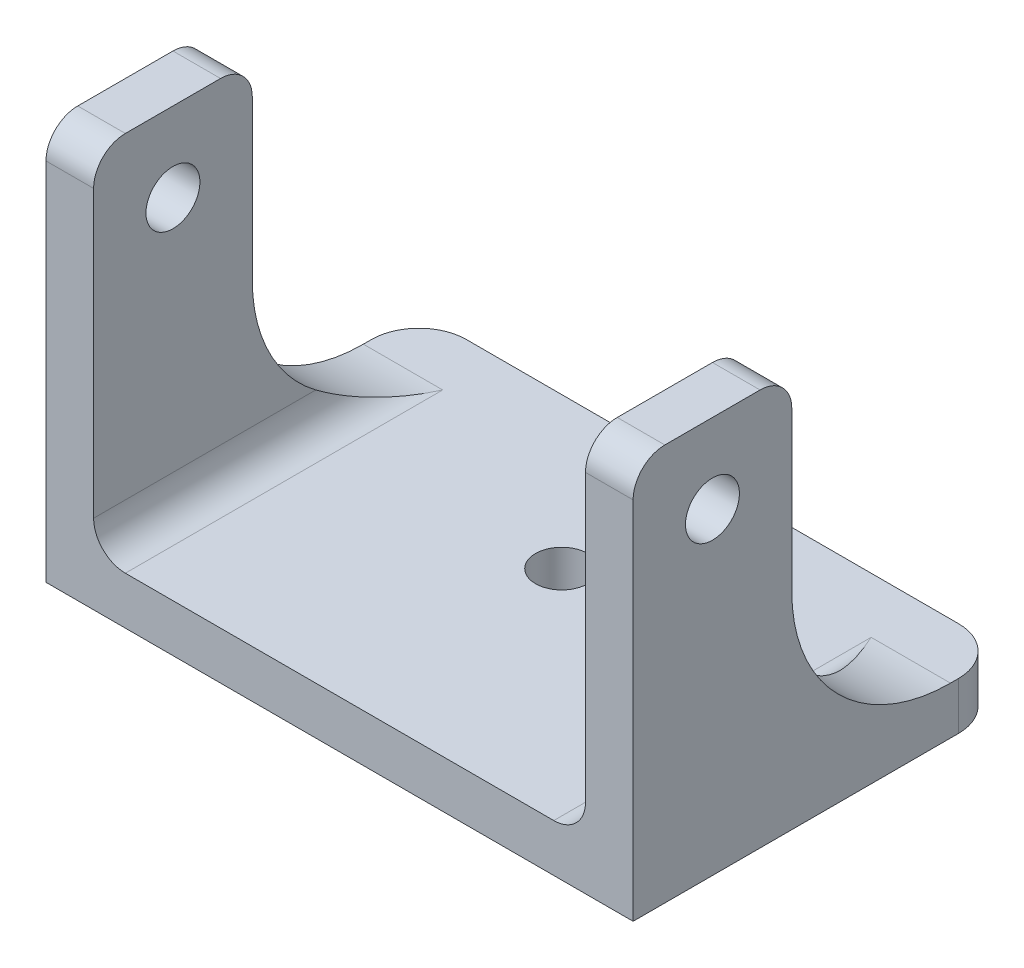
SolidWorks part; units mm, degrees
ref_plane "Plan de face" through (0, 0, 0) normal (0, 0, 1) x (1, 0, 0)
ref_plane "Plan de dessus" through (0, 0, 0) normal (0, 1, 0) x (1, 0, 0)
ref_plane "Plan de droite" through (0, 0, 0) normal (1, 0, 0) x (0, 0, -1)
sketch "Esquisse1" plane through (0, 0, 0) normal (0, 1, 0) x (1, 0, 0)
  line L0 (0, 0) -> (0, 10.9952) construction
  line L1 (-18.5, 9.5) -> (18.5, 9.5)
  line L2 (-18.5, 9.5) -> (-18.5, -14)
  line L3 (-18.5, -14) -> (18.5, -14)
  line L4 (18.5, 9.5) -> (18.5, -14)
  line L5 (0, 0) -> (11.155, 0) construction
  dimension "D1" = 14
  dimension "D2" = 23.5
  dimension "D3" = 37
extrude "Boss.-Extru.1" add sketch "Esquisse1" along normal blind 3
sketch "Esquisse2" plane through (0, 0, 0) normal (0, -1, 0) x (1, 0, 0)
  circle A0 centre (0, 0) radius 7
  dimension "D1" = 14
extrude "Boss.-Extru.2" add sketch "Esquisse2" along normal blind 3
sketch "Esquisse3" plane through (0, -3, 0) normal (0, -1, 0) x (1, 0, 0)
  circle A0 centre (0, 0) radius 1.65
  dimension "D1" = 3.3
extrude "Enlèv. mat.-Extru.1" cut sketch "Esquisse3" against normal up to next
sketch "Esquisse7" plane through (0, 3, 0) normal (0, 1, 0) x (1, 0, 0)
  line L1 (-18.5, -14) -> (-15.5, -14)
  line L2 (-18.5, -14) -> (-18.5, -4)
  line L3 (-18.5, -4) -> (-15.5, -4)
  line L4 (-15.5, -14) -> (-15.5, -4)
  line L5 (18.5, -14) -> (15.5, -14)
  line L6 (18.5, -14) -> (18.5, -4)
  line L7 (18.5, -4) -> (15.5, -4)
  line L8 (15.5, -14) -> (15.5, -4)
  dimension "D1" = 10
  dimension "D2" = 3
extrude "Boss.-Extru.3" add sketch "Esquisse7" along normal blind 22
fillet "Congé2" radius 3 2 edges at (-18.5, 1.5, -9.5) (18.5, 1.5, -9.5)
sketch "Esquisse8" plane through (-18.5, 0, 0) normal (-1, 0, 0) x (0, 0, 1)
  line L0 (4, 25) -> (4, 3) construction
  line L1 (-6.5, 3) -> (4, 3) construction
  circle A0 centre (9, 20) radius 1.7
  dimension "D3" = 3.4
  dimension "D1" = 5
  dimension "D2" = 17
extrude "Enlèv. mat.-Extru.2" cut sketch "Esquisse8" against normal through all
fillet "Congé3" radius 2 4 edges at (17, 25, 14) (17, 25, 4) (-17, 25, 4) (-17, 25, 14)
fillet "Congé4" radius 10 2 edges at (17, 3, 4) (-17, 3, 4)
fillet "Congé5" radius 2 2 edges at (-15.5, 3, 4) (15.5, 3, 4)
